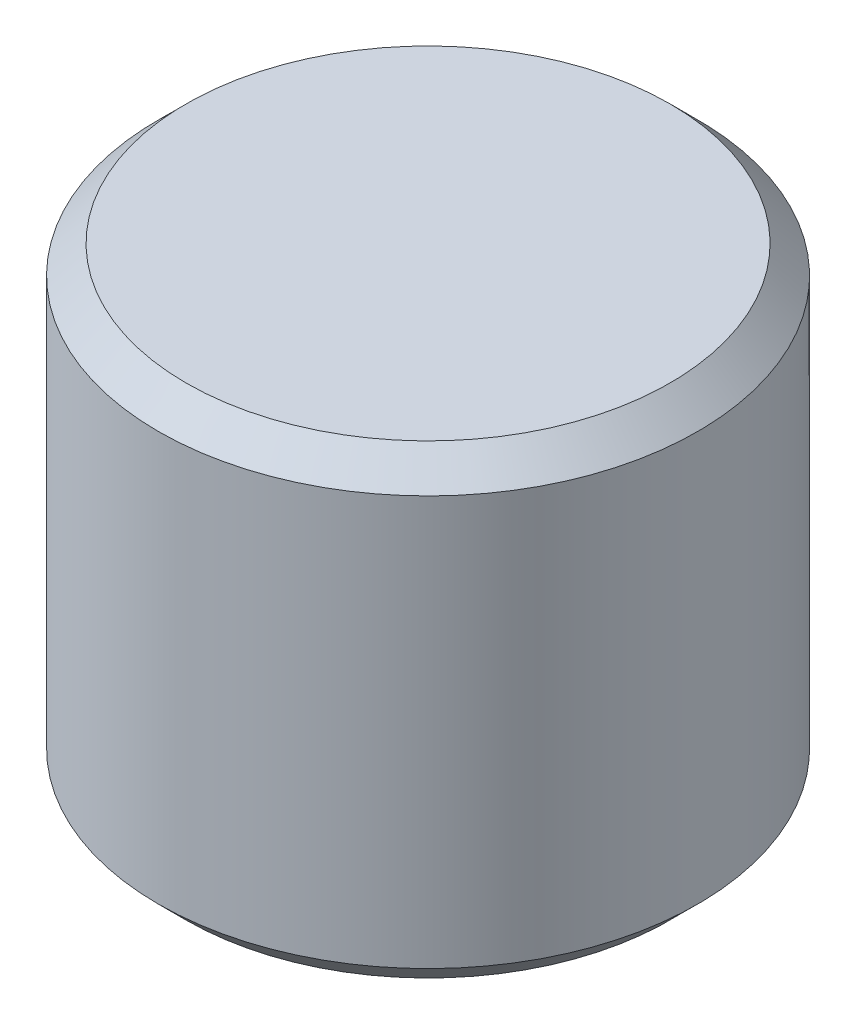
SolidWorks part; units mm, degrees
ref_plane "前视基准面" through (0, 0, 0) normal (0, 0, 1) x (1, 0, 0)
ref_plane "上视基准面" through (0, 0, 0) normal (0, 1, 0) x (1, 0, 0)
ref_plane "右视基准面" through (0, 0, 0) normal (1, 0, 0) x (0, 0, -1)
sketch "草图1" plane through (0, 0, 0) normal (0, 1, 0) x (1, 0, 0)
  circle A0 centre (0, 0) radius 14.5
  dimension "D1" = 29
extrude "凸台-拉伸1" add sketch "草图1" along normal blind 25
chamfer "倒角1" distance 1.5 angle 45 2 edges at (0, 0, 14.5) (0, 25, 14.5)
